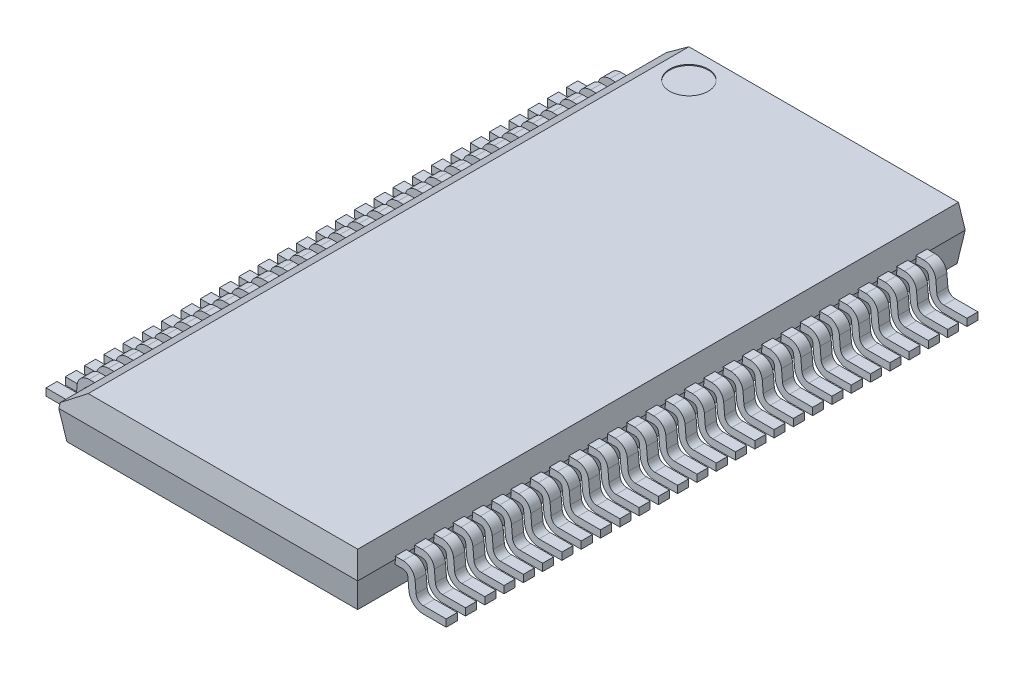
SolidWorks part; units mm, degrees
ref_plane "Front" through (0, 0, 0) normal (0, 0, 1) x (1, 0, 0)
ref_plane "Top" through (0, 0, 0) normal (0, 1, 0) x (1, 0, 0)
ref_plane "Right" through (0, 0, 0) normal (1, 0, 0) x (0, 0, -1)
ref_plane "ПлоскостьВывод1" through (0, 0, -5.4) normal (0, 0, 1) x (1, 0, 0)
sketch "ЭскизВывод1" plane through (0, 0, -5.4) normal (0, 0, 1) x (1, 0, 0)
  line L0 (-4.15, 0) -> (-3.6749, 0)
  line L1 (-3.376, 0.2739) -> (-3.3555, 0.5087)
  line L2 (-3.2559, 0.6) -> (3.2559, 0.6)
  line L3 (0, 0.6) -> (0, 0) construction
  line L4 (3.376, 0.2739) -> (3.3555, 0.5087)
  line L5 (4.15, 0) -> (3.6749, 0)
  arc A0 (-3.3555, 0.5087) -> (-3.2559, 0.6) centre (-3.2559, 0.5) cw
  arc A1 (-3.6749, 0) -> (-3.376, 0.2739) centre (-3.6749, 0.3) ccw
  arc A2 (3.6749, 0) -> (3.376, 0.2739) centre (3.6749, 0.3) cw
  arc A3 (3.3555, 0.5087) -> (3.2559, 0.6) centre (3.2559, 0.5) ccw
  point P8 (-3.3475, 0.6)
  point P11 (-3.4, 0)
  dimension "D6" = 0.1
  dimension "D7" = 0.3
  dimension "E" = 8.3
  dimension "A_mid_lead" = 0.6
  dimension "L" = 0.75
  dimension "D4" = 85
  dimension "D5" = 6.695
extrude "Вывод1" add sketch "ЭскизВывод1" along normal mid plane 0.23 thin
ref_plane "ПлоскостьКорпус" through (0, 0.7, 0) normal (0, 1, 0) x (-1, 0, 0)
sketch "ЭскизКорпус" plane through (0, 0.7, 0) normal (0, 1, 0) x (1, 0, 0)
  line L1 (3.1, -6.3) -> (-3.1, -6.3)
  line L2 (3.1, -6.3) -> (3.1, 6.3)
  line L3 (3.1, 6.3) -> (-3.1, 6.3)
  line L4 (-3.1, -6.3) -> (-3.1, 6.3)
  line L5 (3.1, -6.3) -> (-3.1, 6.3) construction
  line L6 (3.1, 6.3) -> (-3.1, -6.3) construction
  point P0 (0, 0)
  dimension "D" = 12.6
  dimension "E" = 6.2
extrude "Корпус" add sketch "ЭскизКорпус" along normal offset from surface 1.2 draft 8 and the other way offset from surface (0.6 mm away) 0.1 draft 8
pattern_linear "Выводы" count 28 spacing 0.4 along (0, 0, 1) of "Вывод1"
chamfer "Фаска1" distance 0.4 angle 45 1 edges at (-3.0297, 1.2, 0)
sketch "Эскиз3" plane through (0, 1.2, 0) normal (0, 1, 0) x (1, 0, 0)
  line L0 (-2.5597, 5.6297) -> (-1.9597, 5.6297) construction
  line L1 (-2.5597, 6.2297) -> (-2.5597, -6.2297) construction
  line L2 (-1.9597, 5.6297) -> (-1.9597, 6.2297) construction
  line L3 (3.0297, 6.2297) -> (-2.5597, 6.2297) construction
  circle A0 centre (-1.9597, 5.6297) radius 0.4
  dimension "D2" = 0.8
  dimension "D1" = 0.6
extrude "Вытянуть3" cut sketch "Эскиз3" against normal blind 0.02
sketch "SkThermalPad" plane through (0, 0.7, 0) normal (0, 1, 0) x (-1, 0, 0)
  line L1 (2.6, 5.8) -> (-2.6, 5.8)
  line L2 (2.6, 5.8) -> (2.6, -5.8)
  line L3 (2.6, -5.8) -> (-2.6, -5.8)
  line L4 (-2.6, 5.8) -> (-2.6, -5.8)
  line L5 (2.6, 5.8) -> (-2.6, -5.8) construction
  line L6 (2.6, -5.8) -> (-2.6, 5.8) construction
  point P0 (0, 0)
  dimension "D1" = 11.6
  dimension "E2" = 5.2
extrude "ThermalPad" add sketch "SkThermalPad" against normal up to surface (0.7 mm away)
